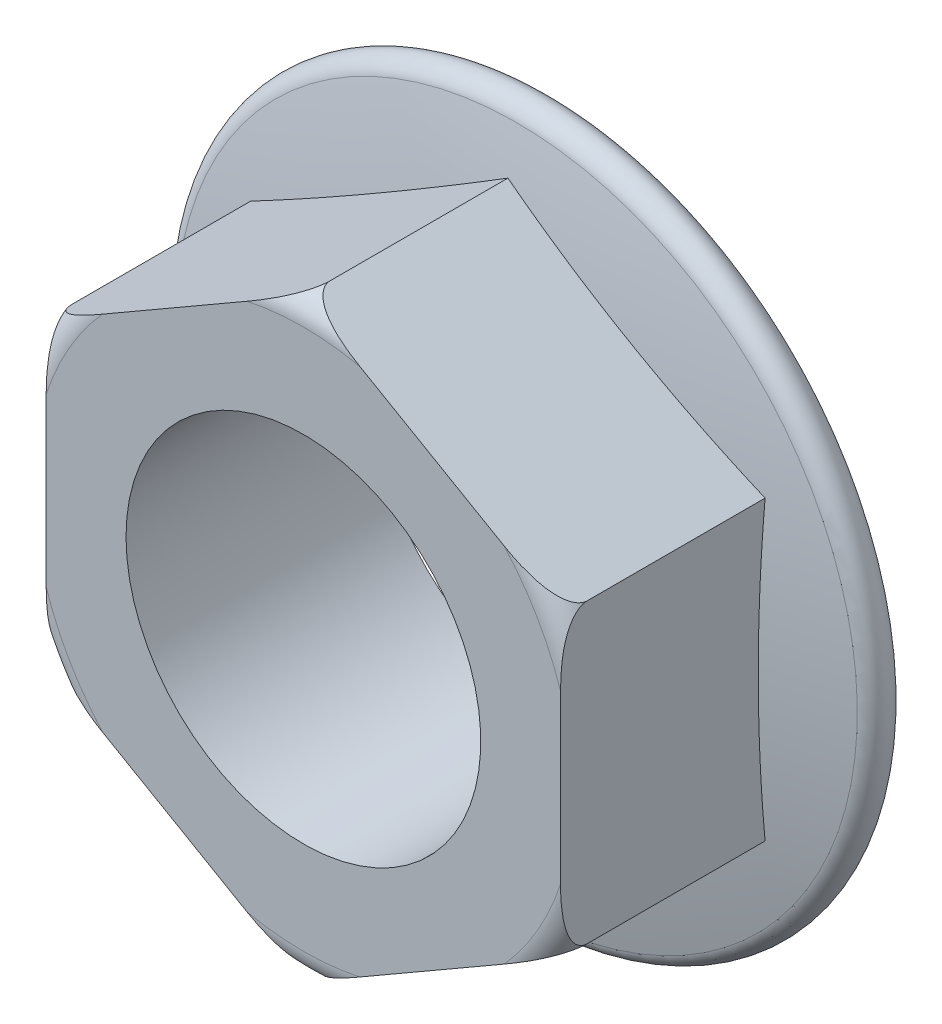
SolidWorks part; units mm, degrees
ref_plane "Plane1" through (0, 0, 0) normal (0, 0, 1) x (1, 0, 0)
ref_plane "Plane2" through (0, 0, 0) normal (0, 1, 0) x (-1, 0, 0)
ref_plane "Plane3" through (0, 0, 0) normal (1, 0, 0) x (0, 0, -1)
sketch "Head Sketch" plane through (0, 0, 0) normal (0, 0, 1) x (1, 0, 0)
  line L0 (0, 33.4863) -> (29, 16.7432)
  line L1 (29, 16.7432) -> (29, -16.7432)
  line L2 (29, -16.7432) -> (0, -33.4863)
  line L3 (0, -33.4863) -> (-29, -16.7432)
  line L4 (-29, -16.7432) -> (-29, 16.7432)
  line L5 (-29, 16.7432) -> (0, 33.4863)
  line L6 (29, 16.7432) -> (-29, -16.7432) construction
  line L7 (0, 33.4863) -> (0, -33.4863) construction
  line L8 (-29, 16.7432) -> (29, -16.7432) construction
  point P0 (0, 0)
  dimension "D1" = 60
  dimension "D2" = 60
  dimension "Flats" = 58
extrude "Head" add sketch "Head Sketch" along normal blind 28
sketch "Flange Sketch" plane through (0, 0, 0) normal (0, 1, 0) x (-1, 0, 0)
  line L0 (0, 1.8434) -> (0, 8) construction
  line L1 (-38, 0) -> (0, 0)
  line L2 (0, 50) -> (0, -50) construction
  line L4 (0, 0) -> (0, 8)
  line L5 (0, 0) -> (-29, 0) construction
  arc A0 (0, 8) -> (-38.4164, 3.9562) centre (0, -176.5) ccw
  arc A1 (-38, 0) -> (-38.4164, 3.9562) centre (-38, 2) cw
  dimension "D1" = 2
  dimension "D3" = 76
  dimension "Flange Height" = 8
revolve "Flange" add sketch "Flange Sketch" angle 360 about L0
sketch "Sketch5" plane through (0, 0, 0) normal (1, 0, 0) x (0, 0, -1)
  line L0 (-28, -30.4863) -> (-28, -33.4863)
  line L1 (-28, -33.4863) -> (-25, -33.4863)
  line L2 (-28, -33.4863) -> (-4.9357, -33.4863) construction
  line L3 (-28, -33.4863) -> (-28, -16.7432) construction
  line L5 (-15.0856, 0) -> (-8.1394, 0) construction
  line L6 (50, 0) -> (-50, 0) construction
  arc A0 (-28, -30.4863) -> (-25, -33.4863) centre (-25, -30.4863) ccw
  dimension "D1" = 3
revolve "Head Trim" cut sketch "Sketch5" angle 360 about L5
sketch "Esquisse1" plane through (0, 0, 0) normal (0, 0, -1) x (-1, 0, 0)
  circle A0 centre (0, 0) radius 20
  dimension "D1" = 40
extrude "Enlèv. mat.-Extru.1" cut sketch "Esquisse1" against normal through all
